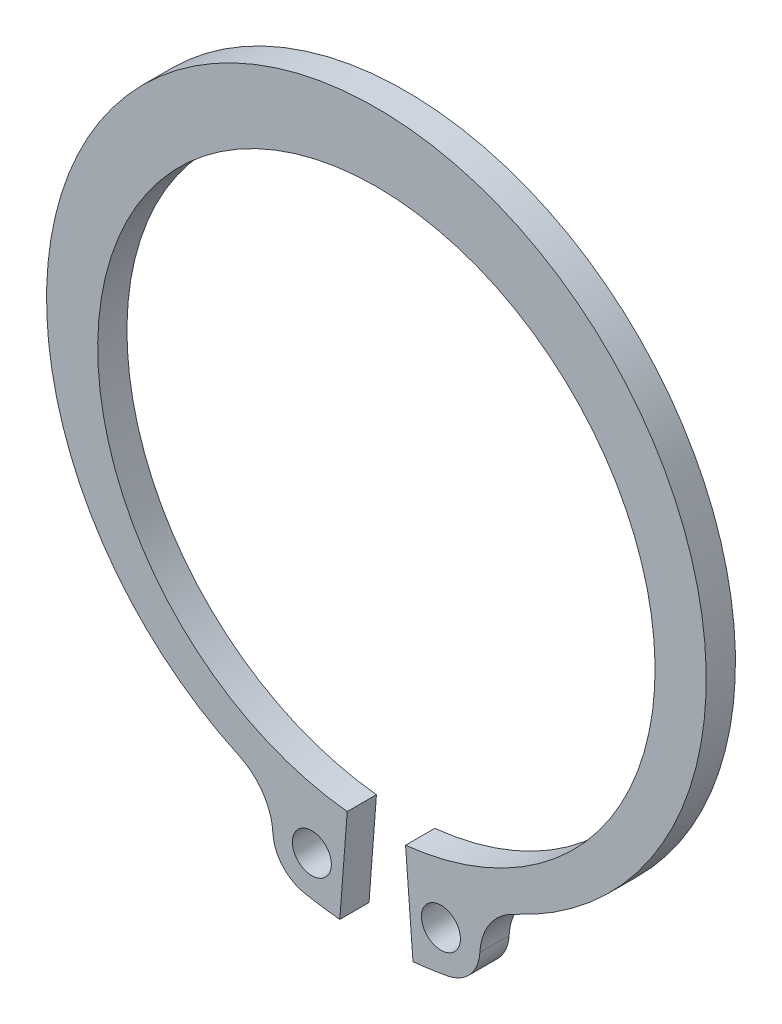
SolidWorks part; units mm, degrees
ref_plane "Face" through (0, 0, 0) normal (0, 0, 1) x (1, 0, 0)
ref_plane "Dessus" through (0, 0, 0) normal (0, 1, 0) x (1, 0, 0)
ref_plane "Droite" through (0, 0, 0) normal (1, 0, 0) x (0, 0, -1)
sketch "Esquisse1" plane through (0, 0, 0) normal (0, 0, 1) x (1, 0, 0)
  line L0 (0, 17.8) -> (0, 14.3) construction
  line L1 (1.4969, -14.2214) -> (1.8774, -19.2069)
  line L2 (-1.4969, -14.2214) -> (-1.8774, -19.2069)
  line L3 (0.4, -13.9443) -> (0.4, -18.9443) construction
  line L4 (-0.4, -13.9443) -> (-0.4, -18.9443) construction
  arc A0 (1.4969, -14.2214) -> (-1.4969, -14.2214) centre (0, 0) ccw
  arc A1 (7.0548, -14.5096) -> (-7.0548, -14.5096) centre (0, 0.875) ccw
  arc A2 (1.8774, -19.2069) -> (3.6949, -18.9415) centre (0, 0) ccw
  circle A3 centre (3.312, -16.9785) radius 1
  arc A4 (3.6949, -18.9415) -> (5.3093, -17.0817) centre (3.312, -16.9785) ccw
  arc A5 (7.0548, -14.5096) -> (5.3093, -17.0817) centre (8.3053, -17.2365) ccw
  circle A6 centre (-3.312, -16.9785) radius 1
  arc A7 (-7.0548, -14.5096) -> (-5.3093, -17.0817) centre (-8.3053, -17.2365) cw
  arc A8 (-3.6949, -18.9415) -> (-5.3093, -17.0817) centre (-3.312, -16.9785) cw
  arc A9 (-1.8774, -19.2069) -> (-3.6949, -18.9415) centre (0, 0) cw
  arc A10 (0.4, -13.9443) -> (-0.4, -13.9443) centre (0, 0) ccw construction
  circle A11 centre (0, 0) radius 15 construction
  dimension "dgorge" = 28.6
  dimension "D3" = 0.875
  dimension "dtrou" = 2
  dimension "D8" = 2
  dimension "D9" = 3
  dimension "dint" = 27.9
  dimension "dn" = 30
  dimension "b" = 3.5
  dimension "a" = 5
  dimension "D5" = 12.017
  dimension "D7" = 1.6
  dimension "D12" = 0.8
  dimension "D13" = 3.286
  dimension "D14" = 4.365
extrude "Base-Extrusion" add sketch "Esquisse1" along normal blind 1.5
equation "\"D3@Esquisse1\" = \"b@Esquisse1\"/4"
equation "\"D7@Esquisse1\"=\"dtrou@Esquisse1\"*0.8"
equation "\"D8@Esquisse1\" = \"dtrou@Esquisse1\""
equation "\"D9@Esquisse1\" = \"dtrou@Esquisse1\"*1.5"
equation "\"D12@Esquisse1\" = \"dtrou@Esquisse1\"*0.4"
equation "\"D5@Esquisse1\" = 360-(360-\"D13@Esquisse1\")*\"dint@Esquisse1\"/\"dgorge@Esquisse1\""
equation "\"D14@Esquisse1\" = (\"D5@Esquisse1\"-\"D13@Esquisse1\")/2"
